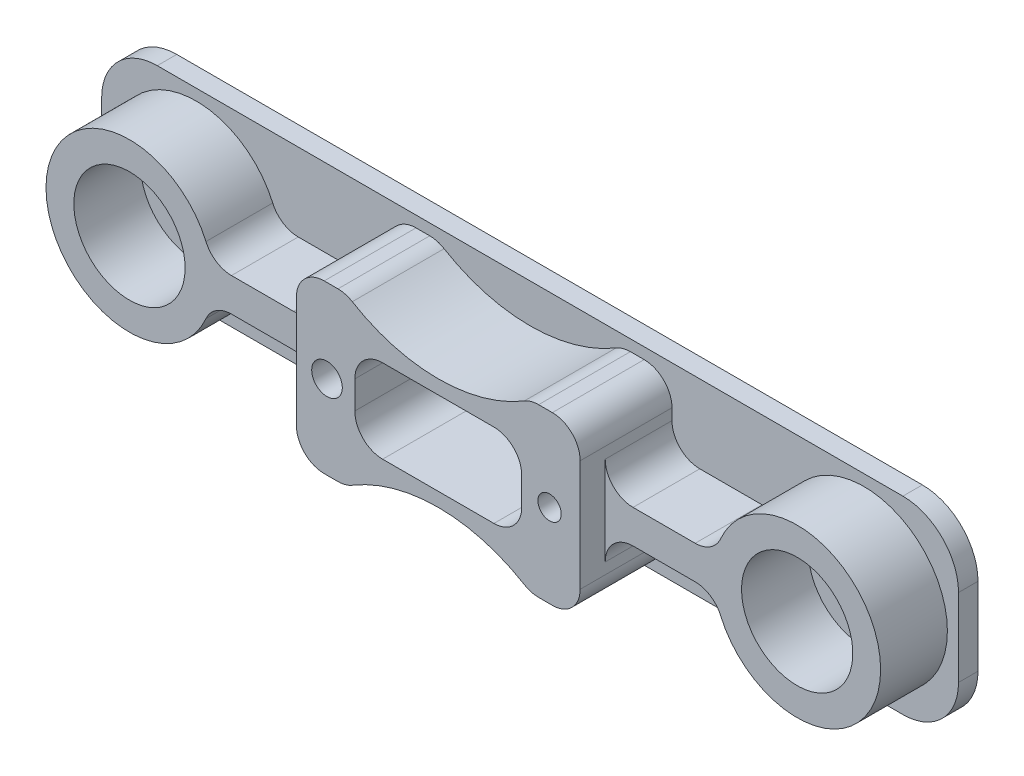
SolidWorks part; units mm, degrees
ref_plane "Ebene vorne" through (0, 0, 0) normal (0, 0, 1) x (1, 0, 0)
ref_plane "Ebene oben" through (0, 0, 0) normal (0, 1, 0) x (1, 0, 0)
ref_plane "Ebene rechts" through (0, 0, 0) normal (1, 0, 0) x (0, 0, -1)
sketch "Skizze1" plane through (0, 0, 0) normal (0, 0, 1) x (1, 0, 0)
  line L3 (-67, -17) -> (67, -17)
  line L4 (-77, -7) -> (-77, 7)
  line L5 (-67, 17) -> (67, 17)
  line L6 (77, -7) -> (77, 7)
  line L7 (-77, -17) -> (77, 17) construction
  line L8 (-77, 17) -> (77, -17) construction
  arc A0 (67, 17) -> (77, 7) centre (67, 7) cw
  arc A1 (67, -17) -> (77, -7) centre (67, -7) ccw
  arc A2 (-67, -17) -> (-77, -7) centre (-67, -7) cw
  arc A3 (-77, 7) -> (-67, 17) centre (-67, 7) cw
  point P5 (0, 0)
  dimension "D3" = 10
  dimension "D1" = 154
  dimension "D2" = 34
extrude "Aufsatz-Linear austragen1" add sketch "Skizze1" along normal blind 3.5
sketch "Skizze2" plane through (0, 0, 3.5) normal (0, 0, 1) x (1, 0, 0)
  line L0 (0, 26.4773) -> (0, -30.6934) construction
  line L1 (-45.3031, 3) -> (45.3031, 3)
  line L2 (-45.3031, -3) -> (45.3031, -3)
  line L3 (-88.2857, 0) -> (82.2145, 0) construction
  circle A0 centre (-60, 0) radius 10
  arc A1 (-45.3031, 3) -> (-45.3031, -3) centre (-60, 0) ccw
  arc A2 (45.3031, 3) -> (45.3031, -3) centre (60, 0) cw
  circle A3 centre (60, 0) radius 10
  point P9 (0, 3)
  point P15 (0, -3)
  dimension "D3" = 30
  dimension "D4" = 20
  dimension "D1" = 120
  dimension "D2" = 6
extrude "Aufsatz-Linear austragen2" add sketch "Skizze2" along normal blind 12
sketch "Skizze3" plane through (0, 0, 3.5) normal (0, 0, 1) x (1, 0, 0)
  line L0 (-27.3107, 0) -> (32.5243, 0) construction
  line L1 (-25.5, 15) -> (-25.5, -15)
  line L2 (-25.5, -15) -> (-16.5831, -15)
  line L3 (25.5, -15) -> (25.5, 15)
  line L4 (0, -20.0617) -> (0, 19.4122) construction
  line L5 (16.5831, -15) -> (25.5, -15)
  line L6 (16.5831, 15) -> (25.5, 15)
  line L7 (-25.5, 15) -> (-16.5831, 15)
  arc A0 (-16.5831, -15) -> (16.5831, -15) centre (0, -40) cw
  arc A1 (-16.5831, 15) -> (16.5831, 15) centre (0, 40) ccw
  point P16 (25.5, 0)
  point P17 (-25.5, 0)
  dimension "D3" = 30
  dimension "D1" = 51
  dimension "D2" = 30
  dimension "D4" = 40
extrude "Aufsatz-Linear austragen3" add sketch "Skizze3" along normal offset from surface (16.5 mm away) 20
sketch "Skizze4" plane through (0, 0, 20) normal (0, 0, 1) x (1, 0, 0)
  line L1 (-15, -7.5) -> (15, -7.5)
  line L2 (-15, -7.5) -> (-15, 7.5)
  line L3 (-15, 7.5) -> (15, 7.5)
  line L4 (15, -7.5) -> (15, 7.5)
  line L5 (-15, -7.5) -> (15, 7.5) construction
  line L6 (-15, 7.5) -> (15, -7.5) construction
  point P0 (0, 0)
  dimension "D1" = 30
  dimension "D2" = 15
extrude "Schnitt-Linear austragen1" cut sketch "Skizze4" against normal blind 16.5
fillet "Verrundung1" radius 5 20 edges at (-15, 7.5, 11.75) (-15, -7.5, 11.75) (15, -7.5, 11.75) (15, 7.5, 11.75) (45.3031, 3, 9.5) (25.5, 3, 9.5) (25.5, 15, 11.75) (16.5831, 15, 11.75) (-16.5831, 15, 11.75) (-25.5, 15, 11.75) (-25.5, 3, 9.5) (-45.3031, 3, 9.5) (45.3031, -3, 9.5) (25.5, -3, 9.5) (25.5, -15, 11.75) (16.5831, -15, 11.75) (-16.5831, -15, 11.75) (-25.5, -15, 11.75) (-25.5, -3, 9.5) (-45.3031, -3, 9.5)
hole_wizard "M5 Gewindebohrung1" positions "Skizze6" profile "Skizze5" tap size "M5" standard "DIN"
sketch "Skizze6" plane through (0, 0, 20) normal (0, 0, 1) x (1, 0, 0)
  point P0 (20, 0)
  dimension "D1" = 20
sketch "Skizze5" plane through (20, 0, 20) normal (1, 0, 0) x (0, -1, 0)
  line L0 (0, 0) -> (0, 18.2618)
  line L1 (0, 18.2618) -> (2.1, 17)
  line L2 (2.1, 17) -> (2.1, 0)
  line L5 (2.1, 0) -> (0, 0)
  line L10 (0, 18.2618) -> (-2.1, 17) construction
  line L11 (0, -6.35) -> (0, 107.95) construction
  dimension "Bohrerdurchmesser" = 4.2
  dimension "Bohrungstiefe" = 17
  dimension "Spitzenwinkel" = 118
hole_wizard "Formsenkung für M5 Senkschraube mit Innensechskant1" positions "Skizze8" profile "Skizze7" countersink size "M5" standard "DIN"
sketch "Skizze8" plane through (5.3502, 4.5982, 0) normal (0, 0, 1) x (1, 0, 0)
  point P0 (-25.3502, -4.5982)
  dimension "D1" = 20
sketch "Skizze7" plane through (-20, 0, 0) normal (1, 0, 0) x (0, 1, 0)
  line L0 (0, 0) -> (0, 20)
  line L1 (0, 20) -> (2.75, 20)
  line L2 (2.75, 20) -> (2.75, 2.95)
  line L3 (2.75, 2.95) -> (5.2, 0.5)
  line L4 (5.2, 0.5) -> (5.2, 0)
  line L6 (5.2, 0) -> (0, 0)
  line L7 (-2.75, 2.95) -> (-5.2, 0.5) construction
  line L11 (0, -6.35) -> (0, 107.95) construction
  dimension "Bohrerdurchmesser" = 5.5
  dimension "Bohrungstiefe" = 20
  dimension "Senkdurchmesser" = 10.4
  dimension "Senkwinkel" = 90
  dimension "Kopfspielraum" = 0.5
